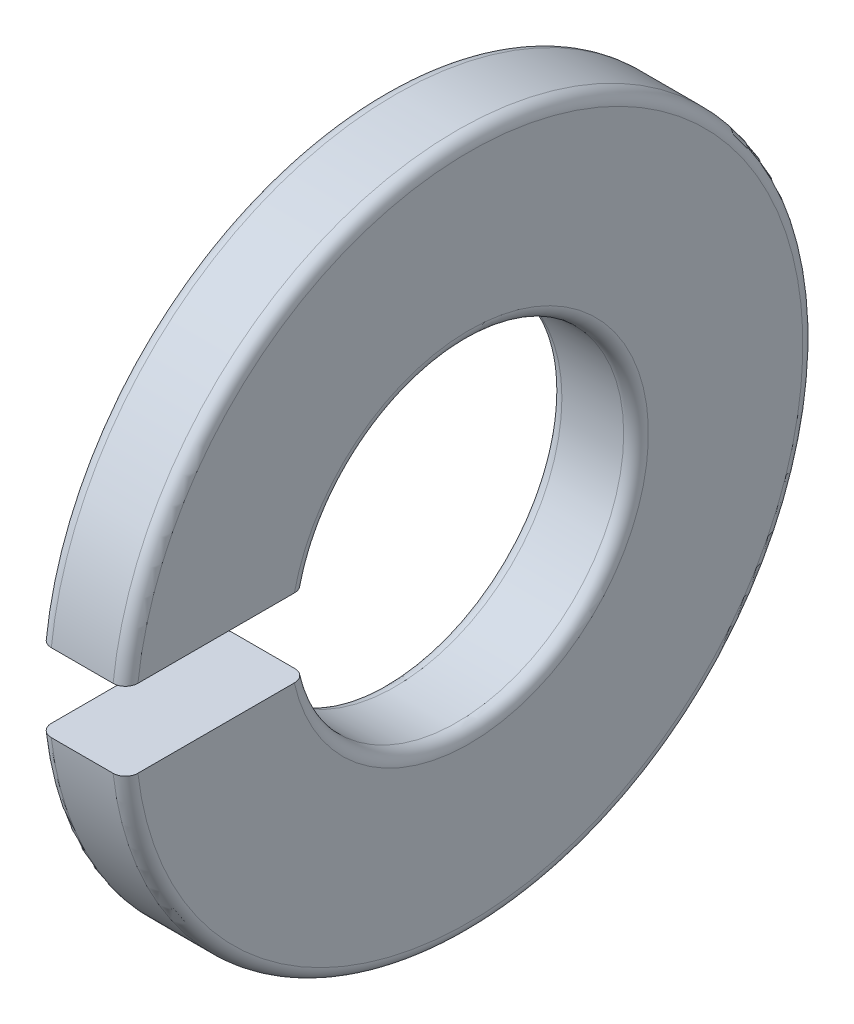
SolidWorks part; units mm, degrees
ref_plane "Plane1" through (0, 0, 0) normal (0, 0, 1) x (1, 0, 0)
ref_plane "Plane2" through (0, 0, 0) normal (0, 1, 0) x (1, 0, 0)
ref_plane "Plane3" through (0, 0, 0) normal (1, 0, 0) x (0, 0, -1)
revolve "Base-Revolve" add sketch "Sketch1" angle 360 about L0
sketch "Sketch1" plane through (0, 0, 0) normal (0, 0, 1) x (1, 0, 0)
  line L0 (-34.925, 0) -> (9.525, 0) construction
  line L1 (0, 1.45) -> (0, 2.7)
  line L2 (-0.1, 2.8) -> (-0.6, 2.8)
  line L3 (-0.7, 2.7) -> (-0.7, 1.45)
  line L4 (-0.6, 1.35) -> (-0.1, 1.35)
  arc A0 (-0.6, 1.35) -> (-0.7, 1.45) centre (-0.6, 1.45) cw
  arc A1 (0, 1.45) -> (-0.1, 1.35) centre (-0.1, 1.45) cw
  arc A2 (-0.6, 2.8) -> (-0.7, 2.7) centre (-0.6, 2.7) ccw
  arc A3 (0, 2.7) -> (-0.1, 2.8) centre (-0.1, 2.7) ccw
  point P8 (-0.7, 1.35)
  point P14 (-0.7, 2.8)
  point P17 (0, 2.8)
  dimension "Fillet_rad" = 0.1
  dimension "D1" = 0.1
  dimension "D2" = 0.1
  dimension "Thickness" = 0.7
  dimension "Inside_dia" = 2.7
  dimension "Outside_dia" = 5.6
extrude "Gap" cut sketch "Sketch2" along normal through all
sketch "Sketch2" plane through (0, 0, 0) normal (-1, 0, 0) x (0, -1, 0)
  line L0 (-0.315, 0) -> (0.315, 0)
  line L1 (0, 0) -> (0, 12.7) construction
  line L2 (0.315, 0) -> (0.315, 2.856)
  line L3 (0.315, 2.856) -> (-0.315, 2.856)
  line L4 (-0.315, 2.856) -> (-0.315, 0)
  dimension "D1" = 0.63
  dimension "D2" = 2.856
equation "\"D1@Sketch1\" = \"Fillet_rad@Sketch1\""
equation "\"D1@Sketch2\" = \"Thickness@Sketch1\" * 0.9"
equation "\"D2@Sketch2\" = \"Outside_dia@Sketch1\" * 0.51"
equation "\"D2@Sketch1\" = \"Fillet_rad@Sketch1\""
